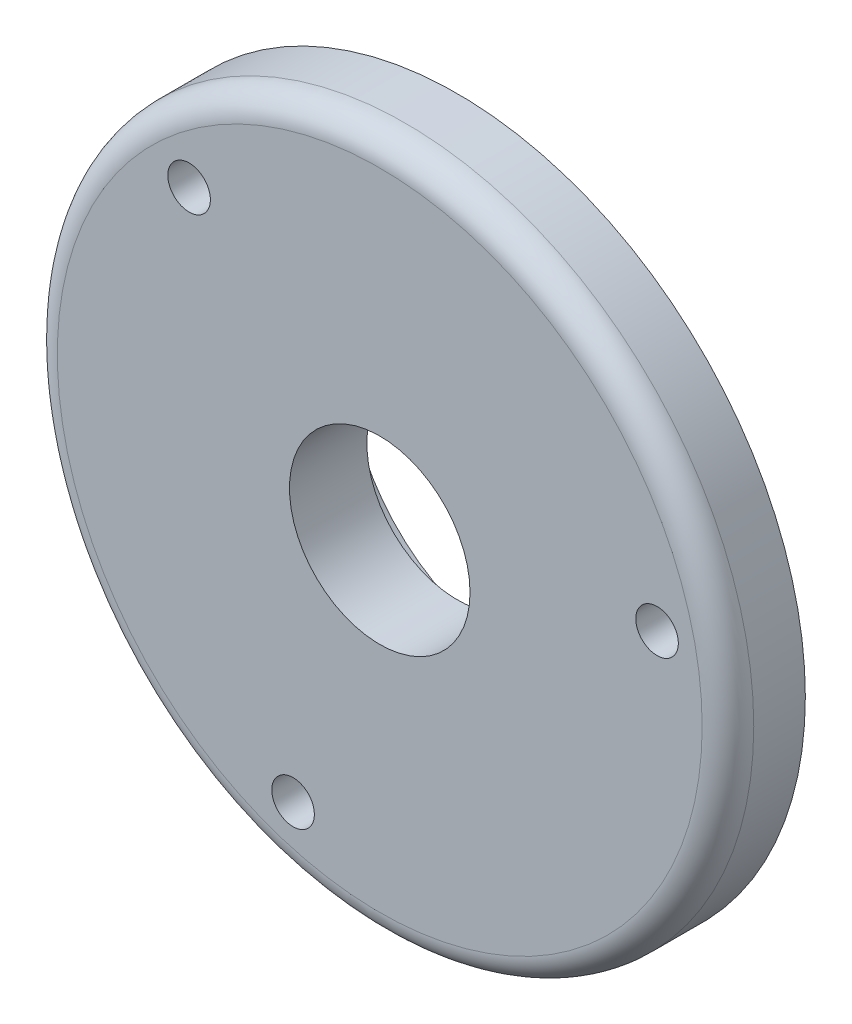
SolidWorks part; units mm, degrees
ref_plane "前视基准面" through (0, 0, 0) normal (0, 0, 1) x (1, 0, 0)
ref_plane "上视基准面" through (0, 0, 0) normal (0, 1, 0) x (1, 0, 0)
ref_plane "右视基准面" through (0, 0, 0) normal (1, 0, 0) x (0, 0, -1)
sketch "草图2" plane through (0, 0, 1.25) normal (0, 0, 1) x (1, 0, 0)
  circle A0 centre (0, 0) radius 13.204
  circle A1 centre (0, 0) radius 17.5
extrude "拉伸1" add sketch "草图2" along normal offset from surface (4.75 mm away) 2
sketch "草图3" plane through (0, 0, 6) normal (0, 0, 1) x (1, 0, 0)
  circle A0 centre (0, 0) radius 7
  circle A1 centre (0, 0) radius 27
  dimension "D1" = 54
  dimension "D2" = 14
extrude "拉伸2" add sketch "草图3" along normal blind 6
hole_wizard "M4 螺纹孔1" positions "草图5" profile "草图4" tap size "M4" standard "ISO"
sketch "草图5" plane through (0, 0, 12) normal (0, 0, 1) x (1, 0, 0)
  point P1 (-6.7202, -20.9485)
  point P4 (-14.7818, 16.2941)
  point P7 (21.502, 4.6544)
sketch "草图4" plane through (-6.7202, -20.9485, 12) normal (1, 0, 0) x (0, -1, 0)
  line L0 (0, 0) -> (0, 10.75)
  line L1 (0, 10.75) -> (1.65, 10.75)
  line L2 (1.65, 10.75) -> (1.65, 0)
  line L5 (1.65, 0) -> (0, 0)
  line L11 (0, -6.35) -> (0, 107.95) construction
  dimension "籵謂蹟恇謂郰芛眻噤" = 3.3
  dimension "籵謂蹟恇謂郰芛旮僅" = 10.75
fillet "圆角1" radius 2 1 edges at (27, 0, 12)
